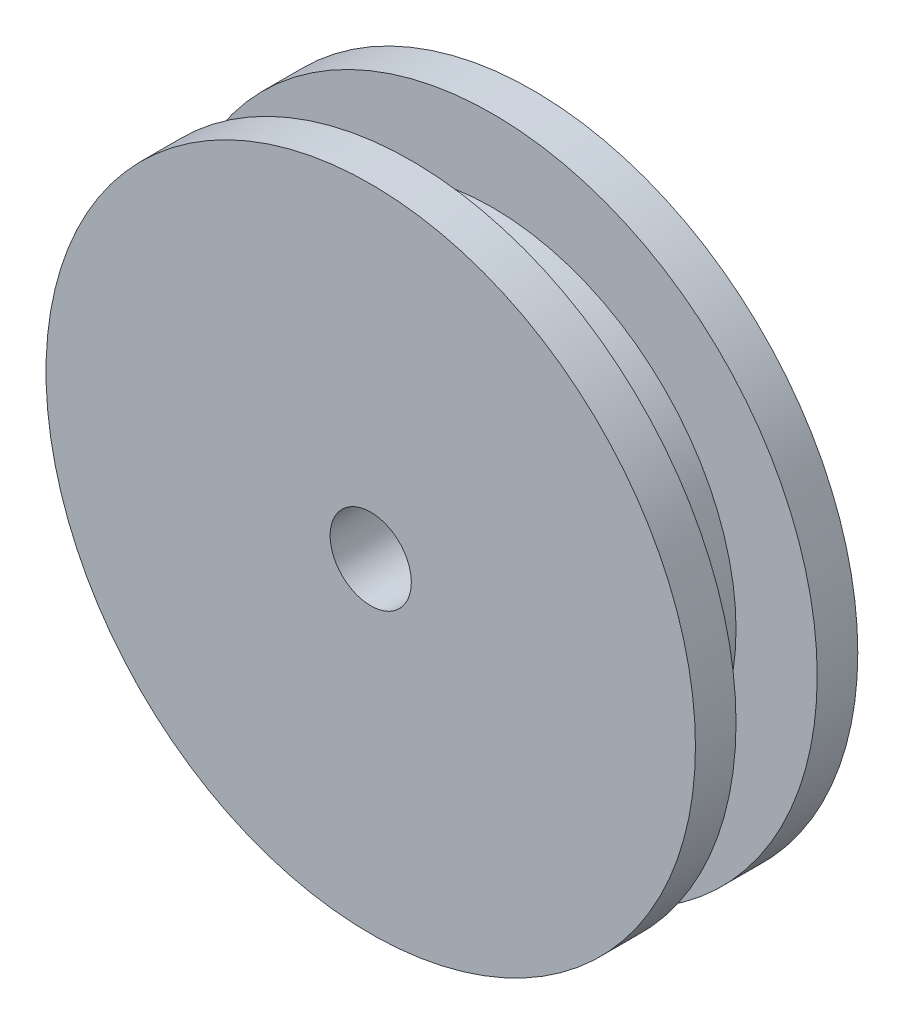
SolidWorks part; units mm, degrees
ref_plane "Front Plane" through (0, 0, 0) normal (0, 0, 1) x (1, 0, 0)
ref_plane "Top Plane" through (0, 0, 0) normal (0, 1, 0) x (1, 0, 0)
ref_plane "Right Plane" through (0, 0, 0) normal (1, 0, 0) x (0, 0, -1)
sketch "Sketch2" plane through (0, 0, 0) normal (1, 0, 0) x (0, 0, -1)
  line L0 (-6.35, 0) -> (6.35, 0)
  line L1 (6.35, 6.35) -> (6.35, 25.4)
  line L2 (6.35, 25.4) -> (3.175, 25.4)
  line L3 (3.175, 25.4) -> (3.175, 19.05)
  line L4 (3.175, 19.05) -> (-3.175, 19.05)
  line L5 (-3.175, 19.05) -> (-3.175, 25.4)
  line L6 (-3.175, 25.4) -> (-6.35, 25.4)
  line L7 (-6.35, 25.4) -> (-6.35, 0)
  line L8 (6.35, 6.35) -> (11.1125, 6.35)
  line L9 (11.1125, 6.35) -> (11.1125, 0)
  line L10 (11.1125, 0) -> (6.35, 0)
  line L11 (6.35, 0) -> (6.35, 6.35) construction
  dimension "D1" = 19.05
  dimension "D2" = 25.4
  dimension "D3" = 3.175
  dimension "D4" = 6.35
  dimension "D5" = 4.7625
  dimension "D6" = 6.35
revolve "Revolve1" add sketch "Sketch2" angle 360 about L0
sketch "Sketch3" plane through (0, 0, 6.35) normal (0, 0, 1) x (1, 0, 0)
  circle A0 centre (0, 0) radius 3.175
  dimension "D1" = 6.35
extrude "Cut-Extrude1" cut sketch "Sketch3" against normal through all
sketch "Sketch4" plane through (0, 0, 0) normal (0, 1, 0) x (1, 0, 0)
  line L1 (0, 11.1125) -> (0, 6.35) construction
  line L2 (6.35, 11.1125) -> (-6.35, 11.1125) construction
  line L3 (25.4, 6.35) -> (-25.4, 6.35) construction
  line L4 (-25.4, -6.35) -> (25.4, -6.35) construction
  circle A0 centre (0, 8.7313) radius 0.9922
  point P10 (0, -6.35)
  dimension "D1" = 15.0813
  dimension "D2" = 1.9844
extrude "Cut-Extrude2" cut sketch "Sketch4" along normal through all
